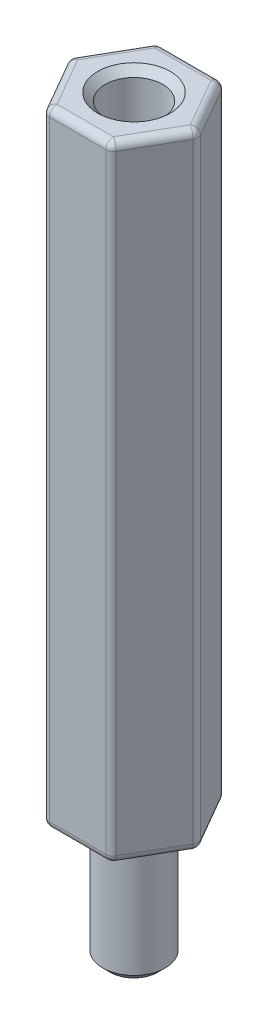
SolidWorks part; units mm, degrees
ref_plane "Front Plane" through (0, 0, 0) normal (0, 0, 1) x (1, 0, 0)
ref_plane "Top Plane" through (0, 0, 0) normal (0, 1, 0) x (1, 0, 0)
ref_plane "Right Plane" through (0, 0, 0) normal (1, 0, 0) x (0, 0, -1)
sketch "Sketch1" plane through (0, 0, 0) normal (0, 1, 0) x (1, 0, 0)
  line L1 (-1.299, 2.25) -> (-2.5981, 0)
  line L2 (-2.5981, 0) -> (-1.299, -2.25)
  line L3 (-1.299, -2.25) -> (1.299, -2.25)
  line L4 (1.299, -2.25) -> (2.5981, 0)
  line L5 (2.5981, 0) -> (1.299, 2.25)
  line L6 (1.299, 2.25) -> (-1.299, 2.25)
  circle A0 centre (0, 0) radius 2.25 construction
  circle A1 centre (0, 0) radius 1.15
  dimension "D2" = 2.3
  dimension "D1" = 4.5
extrude "Boss-Extrude1" add sketch "Sketch1" along normal blind 25
fillet "Fillet1" radius 0.3 6 edges at (1.299, 12.5, -2.25) (2.5981, 12.5, 0) (-1.299, 12.5, -2.25) (-2.5981, 12.5, 0) (-1.299, 12.5, 2.25) (1.299, 12.5, 2.25)
fillet "Fillet2" radius 0.3 24 edges at (-1.2758, 0, 2.2098) (-1.9486, 0, 1.125) (-2.5517, 0, 0) (-1.9486, 0, -1.125) (-1.2758, 0, -2.2098) (0, 0, -2.25) (1.2758, 0, -2.2098) (1.9486, 0, -1.125) (2.5517, 0, 0) (1.9486, 0, 1.125) (1.2758, 0, 2.2098) (-1.2758, 25, 2.2098) (-1.9486, 25, 1.125) (-2.5517, 25, 0) (-1.9486, 25, -1.125) (-1.2758, 25, -2.2098) (0, 25, -2.25) (1.2758, 25, -2.2098) (1.9486, 25, -1.125) (2.5517, 25, 0) (1.9486, 25, 1.125) (1.2758, 25, 2.2098) (0, 0, 2.25) (0, 25, 2.25)
sketch "Sketch2" plane through (0, 0, 0) normal (0, -1, 0) x (1, 0, 0)
  circle A0 centre (0, 0) radius 1.25
  dimension "D1" = 2.5
extrude "Boss-Extrude2" add sketch "Sketch2" along normal blind 5
chamfer "Chamfer1" distance 0.3 angle 45 2 edges at (0, 25, 1.15) (0, -5, -1.25)
fillet "Fillet3" radius 0.3 1 edges at (0, 0, 1.25)
